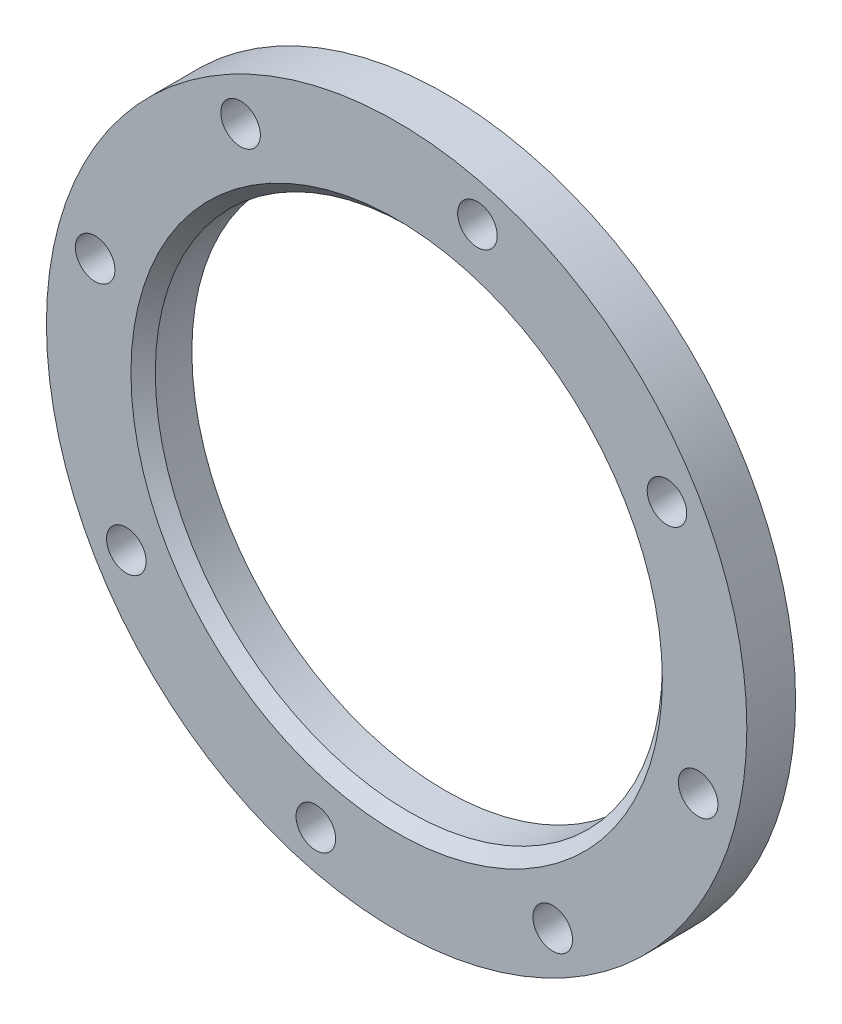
SolidWorks part; units mm, degrees
ref_plane "Front" through (0, 0, 0) normal (0, 0, 1) x (1, 0, 0)
ref_plane "Top" through (0, 0, 0) normal (0, 1, 0) x (1, 0, 0)
ref_plane "Right" through (0, 0, 0) normal (1, 0, 0) x (0, 0, -1)
sketch "Sketch1" plane through (0, 0, 0) normal (0, 0, 1) x (1, 0, 0)
  circle A0 centre (0, 0) radius 230
  circle A1 centre (0, 0) radius 166.5
  dimension "D1" = 460
  dimension "D2" = 333
extrude "Extrude1" add sketch "Sketch1" along normal blind 32
chamfer "Chamfer1" distance 8 angle 45 1 edges at (166.5, 0, 32)
sketch "Sketch2" plane through (0, 0, 32) normal (0, 0, 1) x (1, 0, 0)
  line L0 (0, 108.4216) -> (0, 0) construction
  line L1 (0, 0) -> (53.0579, 198.0148) construction
  circle A0 centre (0, 0) radius 205 construction
  circle A1 centre (53.0579, 198.0148) radius 13
  dimension "D1" = 410
  dimension "D2" = 26
  dimension "D3" = 15
extrude "Cut-Extrude1" cut sketch "Sketch2" against normal through all
pattern_circular "CirPattern1" count 8 over 360 about axis through (0, 0, 0) along (0, 0, 1) of "Cut-Extrude1"
